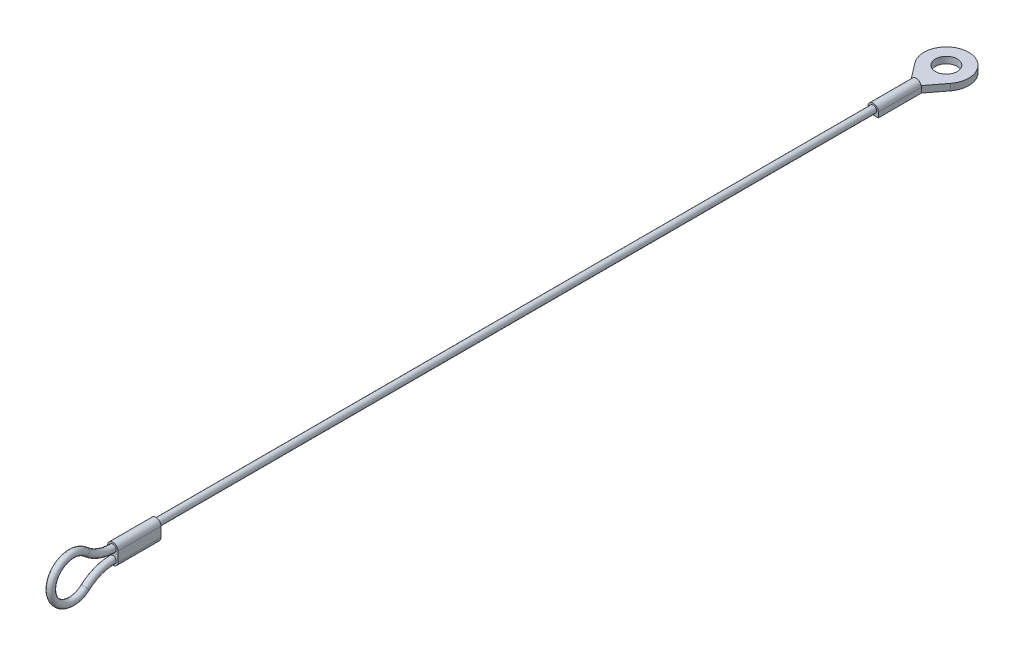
SolidWorks part; units mm, degrees
ref_plane "Front Plane" through (0, 0, 0) normal (0, 0, 1) x (1, 0, 0)
ref_plane "Top Plane" through (0, 0, 0) normal (0, 1, 0) x (1, 0, 0)
ref_plane "Right Plane" through (0, 0, 0) normal (1, 0, 0) x (0, 0, -1)
sketch "Sketch1" plane through (0, 0, 0) normal (1, 0, 0) x (0, 0, -1)
  line L2 (-176.6, 0) -> (0, 0)
  arc A0 (-176.6, 0) -> (-183, 2.4446) centre (-176.6, 9.6) cw
  arc A1 (-183, 2.4446) -> (-183, -4.7108) centre (-186.2, -1.1331) ccw
  arc A2 (-183, -4.7108) -> (-176.6, -2.2663) centre (-176.6, -11.8663) cw
  dimension "D1" = 4.8
  dimension "D4" = 9.6
  dimension "D2" = 186.2
  dimension "D3" = 9.6
sketch "Sketch2" plane through (0, 0, 0) normal (0, 0, 1) x (1, 0, 0)
  circle A0 centre (0, 0) radius 0.795
  dimension "D1" = 1.59
sweep "Sweep1" add profiles "Sketch2" path "Sketch1"
sketch "Sketch3" plane through (0, 0, 176.6) normal (0, 0, -1) x (-1, 0, 0)
  line L0 (0, 0) -> (0, -2.2663) construction
  line L1 (1.195, 0) -> (1.195, -2.2663)
  line L2 (-1.195, 0) -> (-1.195, -2.2663)
  line L3 (-0.795, -2.2663) -> (0.795, -2.2663) construction
  arc A0 (1.195, 0) -> (-1.195, 0) centre (0, 0) ccw
  arc A1 (-1.195, -2.2663) -> (1.195, -2.2663) centre (0, -2.2663) ccw
  point P3 (0, -1.1331)
  dimension "D1" = 2.39
extrude "Boss-Extrude1" add sketch "Sketch3" along normal blind 10
sketch "Sketch4" plane through (0, 0, 0) normal (0, 0, -1) x (-1, 0, 0)
  line L0 (-1.195, 0) -> (-1.195, -1.195)
  line L1 (-1.195, -1.195) -> (0, -1.195)
  line L2 (0, -1.195) -> (1.195, -1.195)
  line L3 (1.195, -1.195) -> (1.195, 0)
  arc A0 (1.195, 0) -> (-1.195, 0) centre (0, 0) ccw
  dimension "D1" = 2.39
extrude "Boss-Extrude2" add sketch "Sketch4" along normal blind 10
sketch "Sketch5" plane through (0, -1.195, 0) normal (0, -1, 0) x (1, 0, 0)
  line L0 (-1.195, -10) -> (1.195, -10)
  line L1 (1.195, -10) -> (4.1323, -13.8352)
  line L2 (-4.1323, -13.8352) -> (-1.195, -10)
  arc A0 (4.1323, -13.8352) -> (-4.1323, -13.8352) centre (0, -17) cw
  circle A1 centre (0, -17) radius 2.54
  point P8 (-5.205, -17)
  point P9 (5.205, -17)
  dimension "D1" = 5.08
  dimension "D2" = 10.41
  dimension "D3" = 17
extrude "Boss-Extrude3" add sketch "Sketch5" against normal blind 1.52
